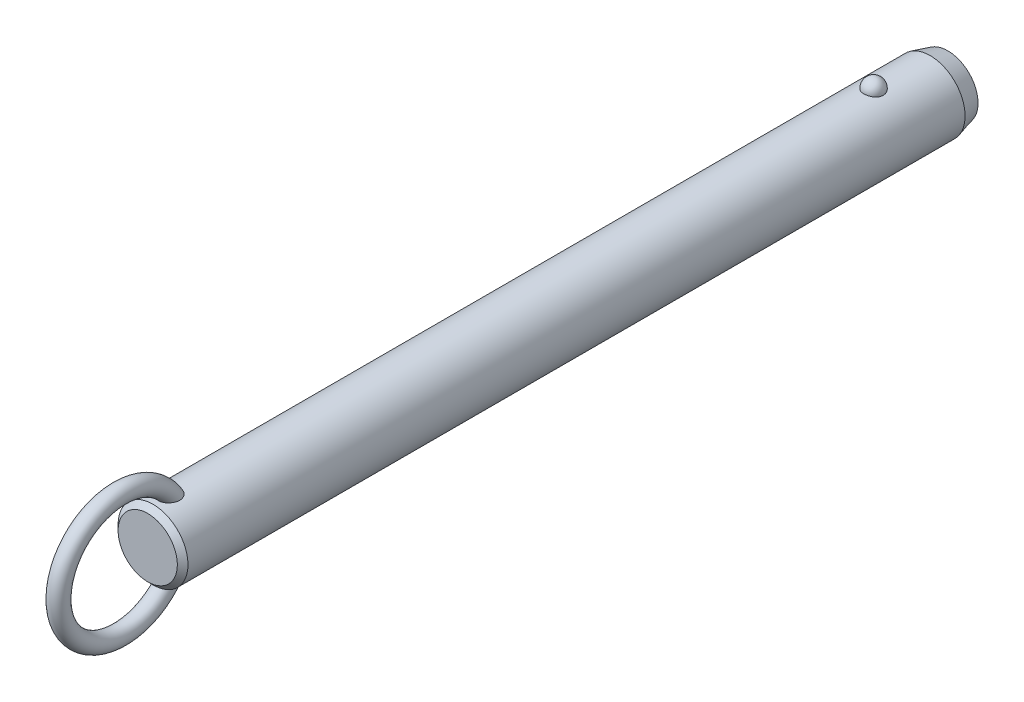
SolidWorks part; units mm, degrees
ref_plane "Front Plane" through (0, 0, 0) normal (0, 0, 1) x (1, 0, 0)
ref_plane "Top Plane" through (0, 0, 0) normal (0, 1, 0) x (1, 0, 0)
ref_plane "Right Plane" through (0, 0, 0) normal (1, 0, 0) x (0, 0, -1)
sketch "Sketch2" plane through (0, 0, 0) normal (0, 0, 1) x (1, 0, 0)
  circle A0 centre (0, 0) radius 7.9
  point P3 (0, 7.9)
  dimension "D1" = 15.8
extrude "Boss-Extrude1" add sketch "Sketch2" along normal blind 152.4
sketch "Sketch3" plane through (0, 0, 0) normal (0, 0, -1) x (-1, 0, 0)
  circle A0 centre (0, 0) radius 7.9
  dimension "D1" = 15.8
extrude "Boss-Extrude2" add sketch "Sketch3" along normal blind 19
chamfer "Chamfer1" distance 4 angle 15 1 edges at (-7.9, 0, -19)
sketch "Sketch12" plane through (0, 0, 0) normal (1, 0, 0) x (0, 0, -1)
  line L0 (-152.4, 7.9) -> (-152.4, -7.9) construction
  point P0 (-152.4, 0)
sketch "Sketch13" plane through (0, 0, 0) normal (1, 0, 0) x (0, 0, -1)
  circle A0 centre (-168.25, 0) radius 15.85
  point P2 (-152.4, 0)
  dimension "D1" = 31.7
sketch "Sketch14" plane through (0, 0, 0) normal (0, 1, 0) x (1, 0, 0)
  circle A0 centre (0, -154.4) radius 2
  point P2 (0, -152.4)
  dimension "D1" = 4
sweep "Sweep1" add profiles "Sketch14" path "Sketch13"
sketch "Sketch15" plane through (0, 0, 152.4) normal (0, 0, 1) x (1, 0, 0)
  circle A0 centre (0, 0) radius 7.9
  dimension "D1" = 15.8
extrude "Boss-Extrude3" add sketch "Sketch15" along normal blind 9.52
chamfer "Chamfer2" distance 1.2 angle 45 1 edges at (7.9, 0, 161.92)
sketch "Sketch18" plane through (0, 0, 0) normal (1, 0, 0) x (0, 0, -1)
  line L0 (15, 7.9) -> (-154.5091, 7.9) construction
  line L1 (2.2, 10.1) -> (2.2, 5.7)
  line L2 (-154.5091, -7.9) -> (15, -7.9) construction
  arc A0 (2.2, 10.1) -> (2.2, 5.7) centre (2.2, 7.9) ccw
  point P4 (0, 7.9)
  dimension "D1" = 18
revolve "Revolve1" add sketch "Sketch18" angle 360 about L1
